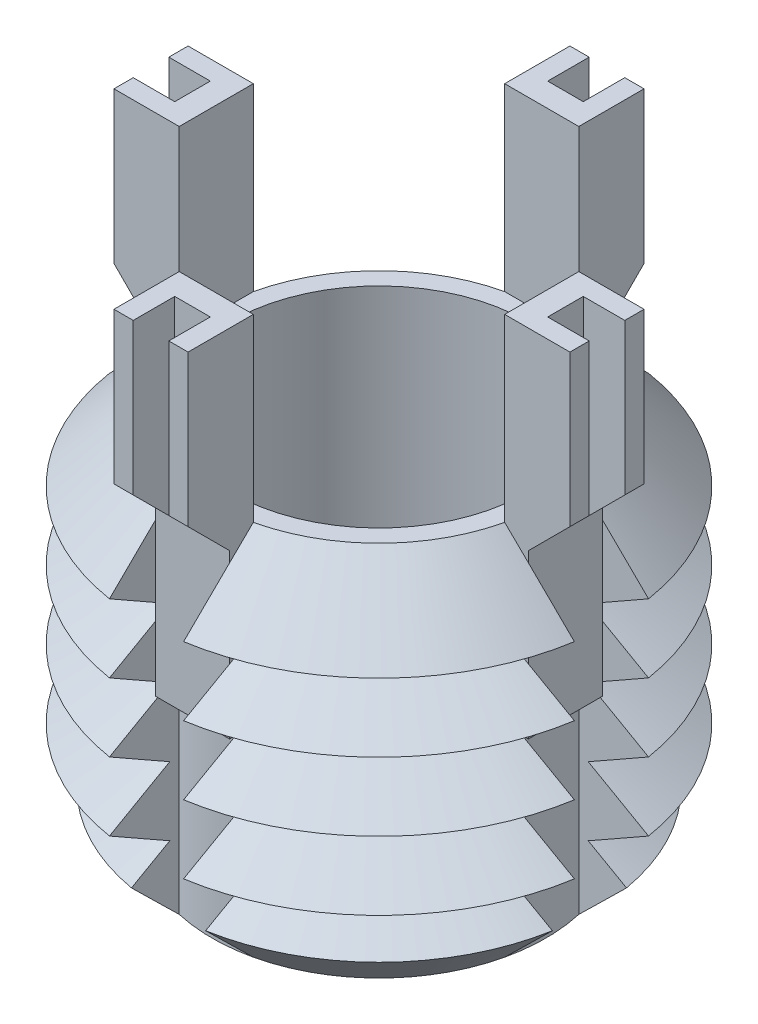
SolidWorks part; units mm, degrees
ref_plane "Front Plane" through (0, 0, 0) normal (0, 0, 1) x (1, 0, 0)
ref_plane "Top Plane" through (0, 0, 0) normal (0, 1, 0) x (1, 0, 0)
ref_plane "Right Plane" through (0, 0, 0) normal (1, 0, 0) x (0, 0, -1)
sketch "Sketch1" plane through (0, 0, 0) normal (0, 1, 0) x (1, 0, 0)
  circle A0 centre (0, 0) radius 7.9375
  dimension "D1" = 15.875
extrude "Boss-Extrude1" add sketch "Sketch1" against normal blind 12.7
chamfer "Chamfer1" distance 2.309 angle 45 2 edges at (0, -12.7, 7.9375) (0, 0, 7.9375)
sketch "Sketch2" plane through (0, 0, 0) normal (1, 0, 0) x (0, 0, -1)
  line L0 (0, 0.8859) -> (0, -9.2617) construction
sketch "Sketch3" plane through (0, 0, 0) normal (1, 0, 0) x (0, 0, -1)
  line L0 (-7.9375, -2.309) -> (-5.9378, -3.4635)
  line L1 (-5.9378, -3.4635) -> (-7.9375, -4.618)
  line L2 (-7.9375, -2.309) -> (-7.9375, -10.391) construction
  line L3 (-7.9375, -4.618) -> (-7.9375, -2.309)
  dimension "D1" = 2.309
revolve "Cut-Revolve1" cut sketch "Sketch3" angle 360 about L0
pattern_linear "LPattern1" count 4 spacing 2.309 along (0, -1, 0) of "Cut-Revolve1"
sketch "Sketch4" plane through (0, 0, 0) normal (0, 1, 0) x (1, 0, 0)
  line L0 (-5.4879, 1.25) -> (-7.8385, 1.25)
  line L2 (-7.8385, -1.25) -> (-5.4879, -1.25)
  arc A0 (-5.4879, 1.25) -> (-5.4879, -1.25) centre (0, 0) ccw
  arc A1 (-7.8385, 1.25) -> (-7.8385, -1.25) centre (0, 0) ccw
  circle A2 centre (0, 0) radius 7.9375 construction
  circle A3 centre (0, 0) radius 5.6285 construction
  point P1 (-5.6285, 0)
  point P3 (-7.9375, 0)
  point P13 (0, 0)
  dimension "D1" = 2.5
extrude "Cut-Extrude1" cut sketch "Sketch4" against normal up to surface (12.7 mm away)
pattern_circular "CirPattern1" count 4 over 360 about axis through (0, 0, 0) along (0, 1, 0) of "Cut-Extrude1"
sketch "Sketch5" plane through (0, 0, 0) normal (1, 0, 0) x (0, 0, -1)
  line L0 (-5.4879, 6.073) -> (-5.4879, -5.927)
  line L1 (-5.4879, -5.927) -> (-6.2879, -5.927)
  line L2 (-6.2879, -5.927) -> (-6.2879, -0.427)
  line L3 (-6.2879, -0.427) -> (-7.6879, 0.973)
  line L4 (-7.6879, 0.973) -> (-7.6879, 6.073)
  line L5 (-7.6879, 6.073) -> (-5.4879, 6.073)
  line L6 (-7.8385, -6.927) -> (-1.25, -6.927) construction
  point P9 (-1.25, 0)
  point P10 (-6.2879, -0.427)
  dimension "D1" = 1
  dimension "D2" = 12
  dimension "D3" = 6.5
  dimension "D4" = 2.2
  dimension "D5" = 0.8
  dimension "D6" = 45
extrude "Boss-Extrude3" add sketch "Sketch5" along normal mid plane 2.5
pattern_circular "CirPattern2" count 4 over 360 about axis through (0, 0, 0) along (0, 1, 0) of "Boss-Extrude3"
sketch "Sketch6" plane through (0, 6.073, 0) normal (0, 1, 0) x (1, 0, 0)
  line L0 (-7.6879, -1.25) -> (-7.6879, 1.25) construction
  line L1 (-7.6879, -0.6) -> (-6.2879, -0.6)
  line L2 (-7.6879, -0.6) -> (-7.6879, 0.6)
  line L3 (-7.6879, 0.6) -> (-6.2879, 0.6)
  line L4 (-6.2879, -0.6) -> (-6.2879, 0.6)
  line L5 (-7.6879, -0.6) -> (-6.2879, 0.6) construction
  line L6 (-7.6879, 0.6) -> (-6.2879, -0.6) construction
  line L7 (7.6879, 1.25) -> (7.6879, -1.25) construction
  line L8 (-0.6, 6.2879) -> (0.6, 6.2879)
  line L9 (-0.6, 6.2879) -> (-0.6, 7.6879)
  line L10 (-0.6, 7.6879) -> (0.6, 7.6879)
  line L11 (0.6, 6.2879) -> (0.6, 7.6879)
  line L12 (-0.6, 6.2879) -> (0.6, 7.6879) construction
  line L13 (-0.6, 7.6879) -> (0.6, 6.2879) construction
  line L14 (6.2879, -0.6) -> (7.6879, -0.6)
  line L15 (6.2879, -0.6) -> (6.2879, 0.6)
  line L16 (6.2879, 0.6) -> (7.6879, 0.6)
  line L17 (7.6879, -0.6) -> (7.6879, 0.6)
  line L18 (6.2879, -0.6) -> (7.6879, 0.6) construction
  line L19 (6.2879, 0.6) -> (7.6879, -0.6) construction
  line L20 (-0.6, -7.6879) -> (0.6, -7.6879)
  line L21 (-0.6, -7.6879) -> (-0.6, -6.2879)
  line L22 (-0.6, -6.2879) -> (0.6, -6.2879)
  line L23 (0.6, -7.6879) -> (0.6, -6.2879)
  line L24 (-0.6, -7.6879) -> (0.6, -6.2879) construction
  line L25 (-0.6, -6.2879) -> (0.6, -7.6879) construction
  line L26 (-1.25, 7.6879) -> (1.25, 7.6879) construction
  line L27 (1.25, -7.6879) -> (-1.25, -7.6879) construction
  point P0 (-6.9879, 0)
  point P7 (-7.6879, 0)
  point P8 (-7.6879, 0)
  point P9 (0, 6.9879)
  point P14 (6.9879, 0)
  point P19 (0, -6.9879)
  point P24 (0, 7.6879)
  point P25 (7.6879, 0)
  point P26 (7.6879, 0)
  point P27 (0, 7.6879)
  point P30 (0, -7.6879)
  point P33 (0, -7.6879)
  dimension "D1" = 1.2
  dimension "D2" = 1.4
extrude "Cut-Extrude3" cut sketch "Sketch6" against normal up to surface (5.1 mm away)
sketch "Sketch7" plane through (0, 0, 0) normal (0, 1, 0) x (1, 0, 0)
  circle A0 centre (0, 0) radius 5
  dimension "D1" = 10
extrude "Cut-Extrude4" cut sketch "Sketch7" against normal up to surface (12.7 mm away)
